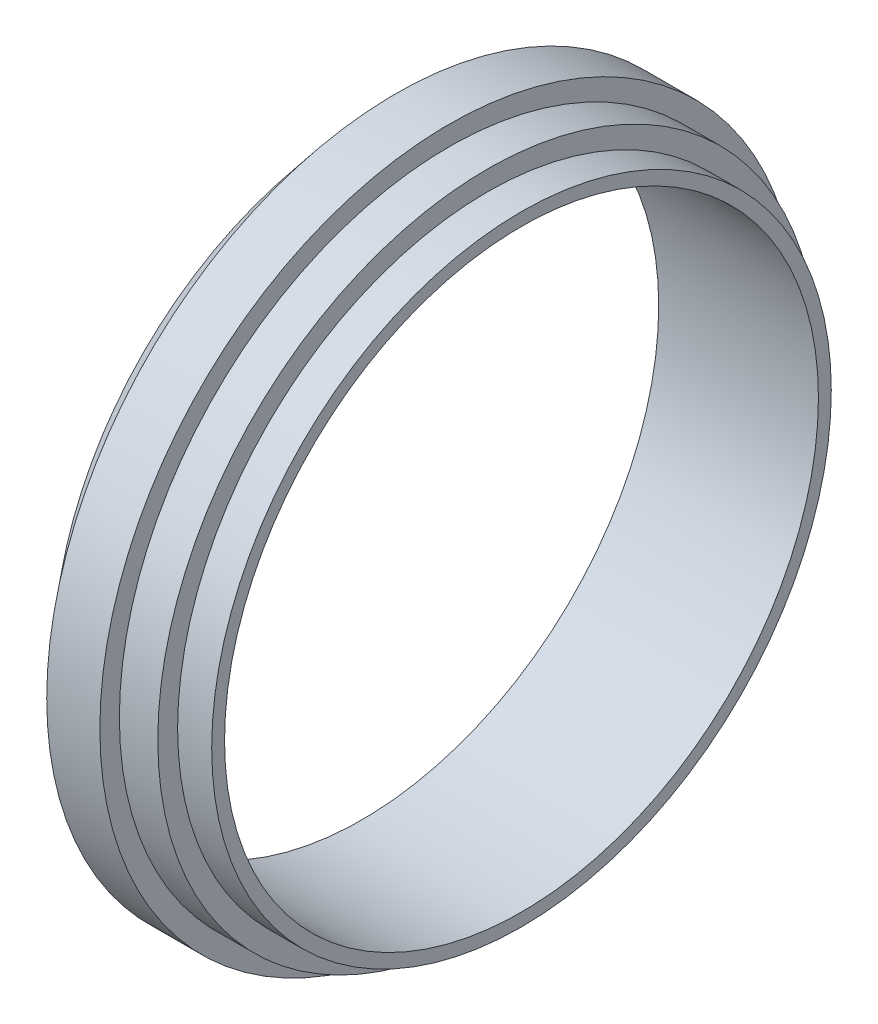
SolidWorks part; units mm, degrees
ref_plane "Front Plane" through (0, 0, 0) normal (0, 0, 1) x (1, 0, 0)
ref_plane "Top Plane" through (0, 0, 0) normal (0, 1, 0) x (1, 0, 0)
ref_plane "Right Plane" through (0, 0, 0) normal (1, 0, 0) x (0, 0, -1)
sketch "Sketch1" plane through (0, 0, 0) normal (0, 0, 1) x (1, 0, 0)
  line L0 (0, 0) -> (-5.588, 0)
  line L1 (-5.588, 0) -> (-5.588, -3.2512)
  line L2 (-5.588, -3.2512) -> (-11.8872, -3.2512)
  line L3 (-11.8872, -3.2512) -> (-11.8872, -6.4516)
  line L4 (-11.8872, -6.4516) -> (-20.5994, -6.4516)
  line L5 (-20.5994, -6.4516) -> (-26.1874, 0.3048)
  line L6 (-26.1874, 0.3048) -> (-26.1874, 50.8)
  line L7 (-26.1874, 50.8) -> (0, 50.8)
  line L8 (0, 50.8) -> (0, 0)
  dimension "D1" = 50.8
  dimension "D2" = 5.588
  dimension "D3" = 14.3002
  dimension "D4" = 20.5994
  dimension "D5" = 26.1874
  dimension "D6" = 50.4952
  dimension "D7" = 57.2516
  dimension "D8" = 54.0512
revolve "Revolve1" add sketch "Sketch1" angle 360 about L7
sketch "Sketch4" plane through (-26.1874, 0, 0) normal (-1, 0, 0) x (0, 0, 1)
  circle A0 centre (0, 50.8) radius 48.6918
extrude "Cut-Extrude1" cut sketch "Sketch4" against normal through all contours A0
